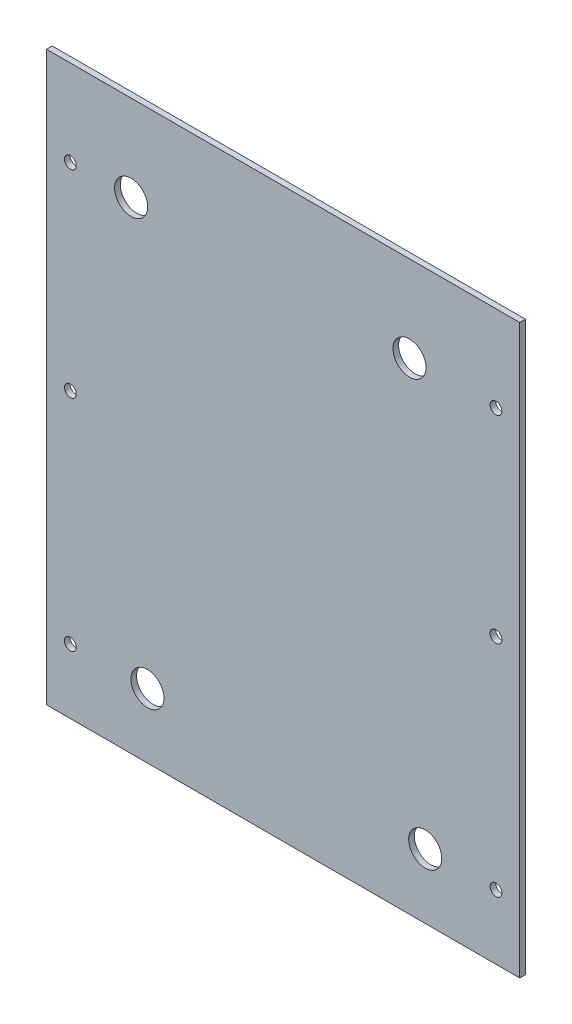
SolidWorks part; units mm, degrees
ref_plane "Front Plane" through (0, 0, 0) normal (0, 0, 1) x (1, 0, 0)
ref_plane "Top Plane" through (0, 0, 0) normal (0, 1, 0) x (1, 0, 0)
ref_plane "Right Plane" through (0, 0, 0) normal (1, 0, 0) x (0, 0, -1)
sketch "Sketch1" plane through (0, 0, 0) normal (0, 0, 1) x (1, 0, 0)
  line L0 (-127, 152.4) -> (-114.2559, 152.4) construction
  line L1 (-127, -152.4) -> (127, -152.4)
  line L2 (-127, -152.4) -> (-127, 152.4)
  line L3 (-127, 152.4) -> (127, 152.4)
  line L4 (127, -152.4) -> (127, 152.4)
  line L5 (-127, -152.4) -> (127, 152.4) construction
  line L6 (-127, 152.4) -> (127, -152.4) construction
  line L7 (-114.2559, 152.4) -> (-114.2559, -152.4) construction
  line L8 (-114.2559, -152.4) -> (-127, -152.4) construction
  line L9 (127, 152.4) -> (114.2559, 152.4) construction
  line L10 (114.2559, 152.4) -> (114.2559, -152.4) construction
  line L11 (114.2559, -152.4) -> (127, -152.4) construction
  line L12 (0, 152.4) -> (0, -152.4) construction
  circle A0 centre (-114.2559, 106.2355) radius 3.175
  circle A1 centre (-114.2559, 0) radius 3.175
  circle A2 centre (-114.2559, -117.7737) radius 3.175
  circle A3 centre (114.2559, -117.7737) radius 3.175
  circle A4 centre (114.2559, 0) radius 3.175
  circle A5 centre (114.2559, 106.2355) radius 3.175
  circle A6 centre (-81.6114, 106.2355) radius 8.89
  circle A7 centre (67.8219, 106.2355) radius 8.89
  circle A8 centre (-72.8693, -117.7737) radius 8.89
  circle A9 centre (76.2644, -117.7737) radius 8.89
  point P0 (0, 0)
  dimension "D3" = 6.35
  dimension "D4" = 17.78
  dimension "D1" = 304.8
  dimension "D2" = 254
extrude "Boss-Extrude1" add sketch "Sketch1" along normal blind 3.048
